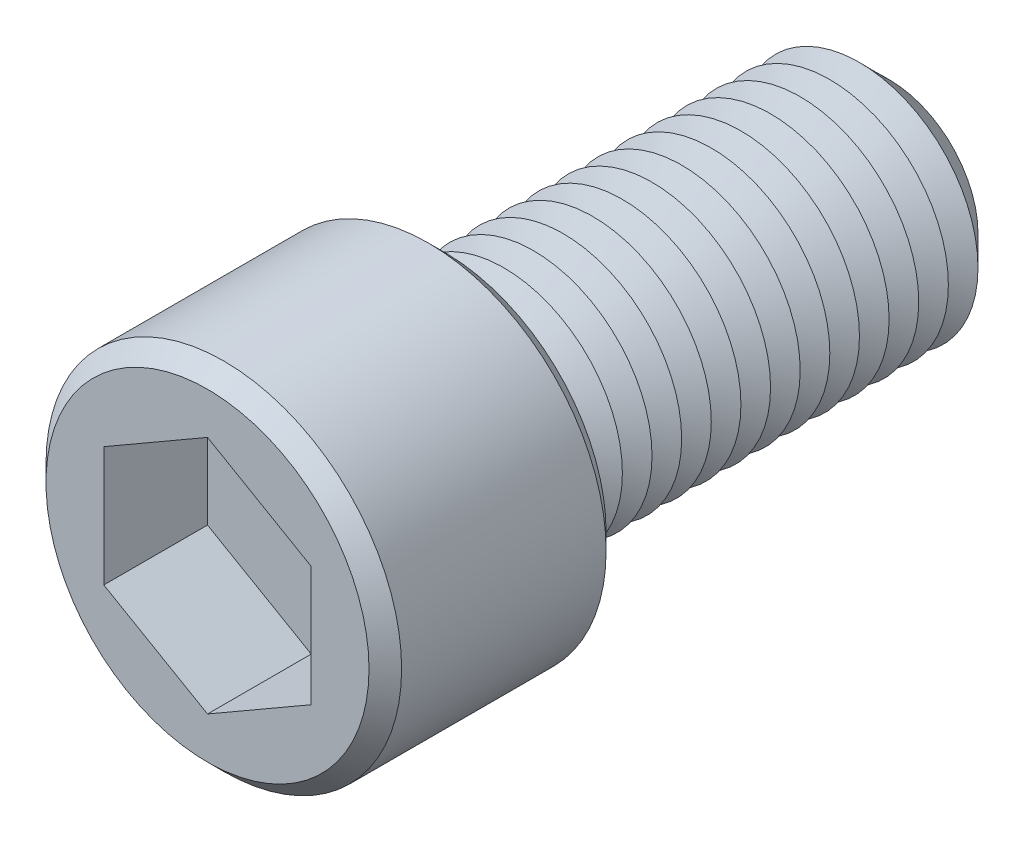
SolidWorks part; units mm, degrees
ref_plane "Front Plane" through (0, 0, 0) normal (0, 0, 1) x (1, 0, 0)
ref_plane "Top Plane" through (0, 0, 0) normal (0, 1, 0) x (1, 0, 0)
ref_plane "Right Plane" through (0, 0, 0) normal (1, 0, 0) x (0, 0, -1)
sketch "Sketch1" plane through (0, 0, 0) normal (0, 0, 1) x (1, 0, 0)
  circle A0 centre (0, 0) radius 12
  dimension "D1" = 24
extrude "Boss-Extrude1" add sketch "Sketch1" along normal blind 16
sketch "Sketch2" plane through (0, 0, 0) normal (0, 0, -1) x (-1, 0, 0)
  circle A0 centre (0, 0) radius 8
  dimension "D1" = 16
extrude "Boss-Extrude2" add sketch "Sketch2" along normal blind 30
chamfer "Chamfer1" distance 2 angle 45 1 edges at (-8, 0, -30)
sketch "Sketch3" plane through (0, 0, 0) normal (1, 0, 0) x (0, 0, -1)
  line L0 (-2.5121, 0) -> (4.5776, 0) construction
sketch "Sketch4" plane through (0, 0, 0) normal (1, 0, 0) x (0, 0, -1)
  line L0 (0, 8) -> (1, 6.2679)
  line L1 (1, 6.2679) -> (2, 8)
  line L2 (28, 8) -> (0, 8) construction
  line L3 (2, 8) -> (0, 8)
  dimension "D1" = 2
revolve "Cut-Revolve1" cut sketch "Sketch4" angle 360 about L0
pattern_linear "LPattern1" count 14 spacing 2 along (0, 0, -1) of "Cut-Revolve1"
sketch "Sketch5" plane through (0, 0, 16) normal (0, 0, 1) x (1, 0, 0)
  line L1 (0, 8.0829) -> (-7, 4.0415)
  line L2 (-7, 4.0415) -> (-7, -4.0415)
  line L3 (-7, -4.0415) -> (0, -8.0829)
  line L4 (0, -8.0829) -> (7, -4.0415)
  line L5 (7, -4.0415) -> (7, 4.0415)
  line L6 (7, 4.0415) -> (0, 8.0829)
  circle A0 centre (0, 0) radius 7 construction
  dimension "D1" = 14
extrude "Cut-Extrude1" cut sketch "Sketch5" against normal blind 7
sketch "Sketch6" plane through (0, 0, 9) normal (0, 0, 1) x (1, 0, 0)
  circle A0 centre (0, 0) radius 0.9
  dimension "D1" = 1.8
extrude "Cut-Extrude2" cut sketch "Sketch6" against normal up to surface (39 mm away)
chamfer "Chamfer2" distance 1.1 angle 45 2 edges at (12, 0, 0) (12, 0, 16)
